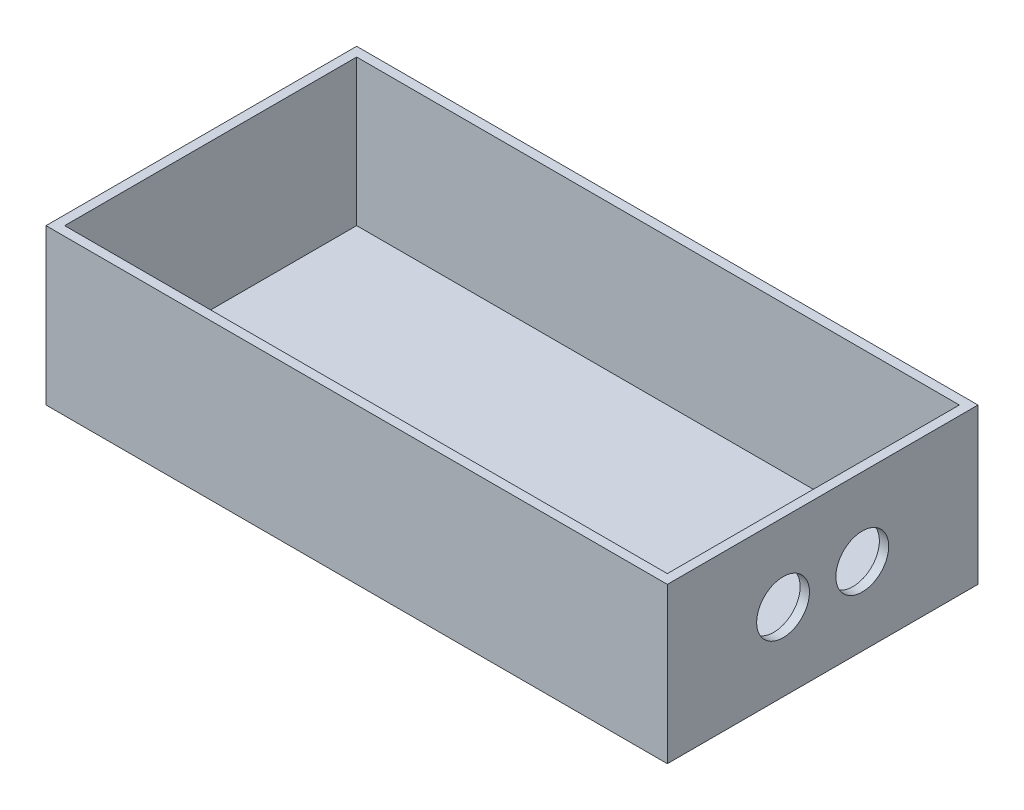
SolidWorks part; units mm, degrees
ref_plane "Front Plane" through (0, 0, 0) normal (0, 0, 1) x (1, 0, 0)
ref_plane "Top Plane" through (0, 0, 0) normal (0, 1, 0) x (1, 0, 0)
ref_plane "Right Plane" through (0, 0, 0) normal (1, 0, 0) x (0, 0, -1)
sketch "Sketch1" plane through (0, 0, 0) normal (0, 0, 1) x (1, 0, 0)
  line L1 (-100, -25) -> (100, -25)
  line L2 (-100, -25) -> (-100, 25)
  line L3 (-100, 25) -> (100, 25)
  line L4 (100, -25) -> (100, 25)
  line L5 (-100, -25) -> (100, 25) construction
  line L6 (-100, 25) -> (100, -25) construction
  point P0 (0, 0)
extrude "Boss-Extrude1" add sketch "Sketch1" along normal blind 100
shell "Shell1" thickness 3
sketch "Sketch2" plane through (100, 0, 0) normal (1, 0, 0) x (0, 0, -1)
  line L0 (0, 0) -> (-100, 0) construction
  line L1 (-100, -25) -> (-100, 25) construction
  line L2 (-50, 25) -> (-50, -25) construction
  line L3 (-100, 25) -> (0, 25) construction
  line L4 (-100, -25) -> (0, -25) construction
  circle A0 centre (-62.75, 0) radius 8.5
  circle A1 centre (-37.25, 0) radius 8.5
  point P15 (-50, 0)
  dimension "D1" = 25.5
  dimension "D2" = 12.75
extrude "Cut-Extrude1" cut sketch "Sketch2" against normal blind 3 and the other way through all
